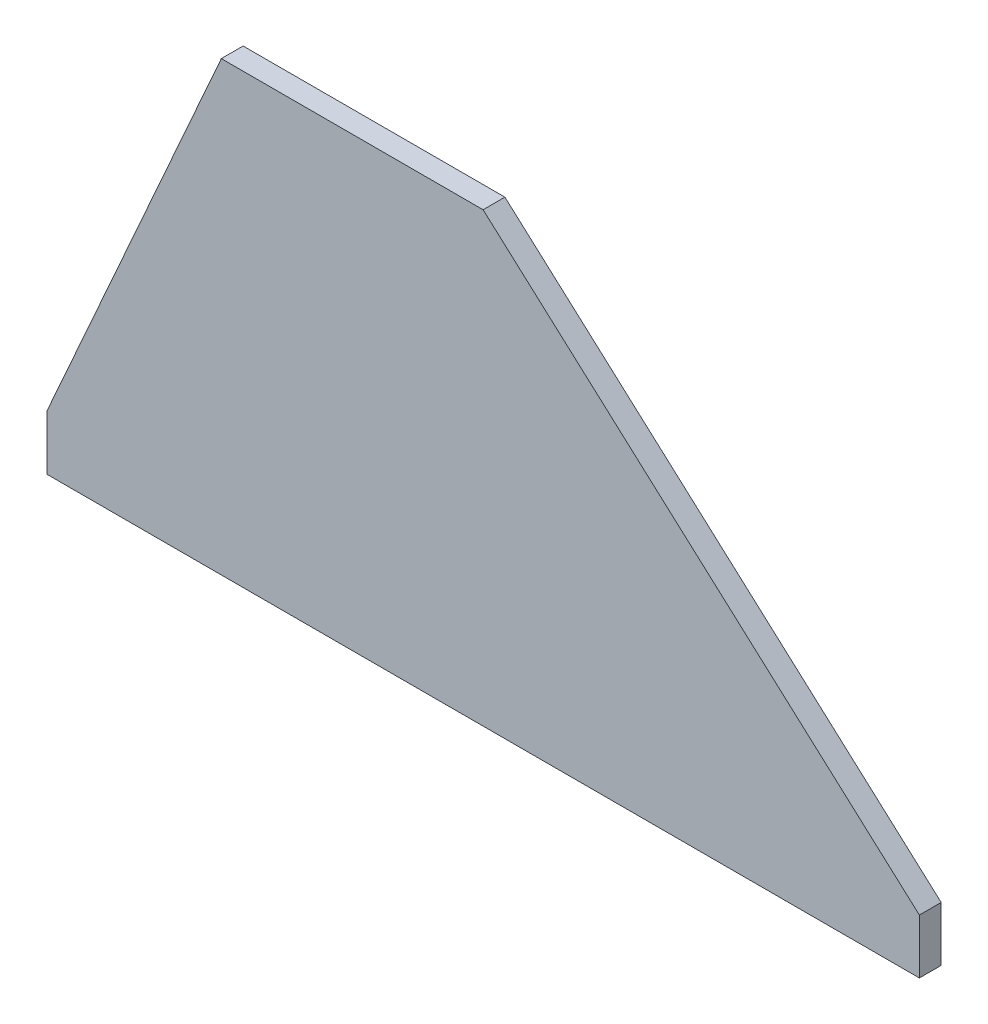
SolidWorks part; units mm, degrees
ref_plane "Front Plane" through (0, 0, 0) normal (0, 0, 1) x (1, 0, 0)
ref_plane "Top Plane" through (0, 0, 0) normal (0, 1, 0) x (1, 0, 0)
ref_plane "Right Plane" through (0, 0, 0) normal (1, 0, 0) x (0, 0, -1)
sketch "Sketch2" plane through (0, 0, 0) normal (0, 0, 1) x (1, 0, 0)
  line L1 (127, 0) -> (63.5, 57.15)
  line L2 (63.5, 57.15) -> (25.4, 57.15)
  line L3 (25.4, 57.15) -> (0, 0)
  line L4 (127, 0) -> (127, -7.9375)
  line L5 (0, 0) -> (0, -7.9375)
  line L6 (0, -7.9375) -> (127, -7.9375)
  dimension "D1" = 127
  dimension "D2" = 63.5
  dimension "D3" = 25.4
  dimension "D5" = 7.9375
extrude "Extrude1" add sketch "Sketch2" along normal blind 3.175
